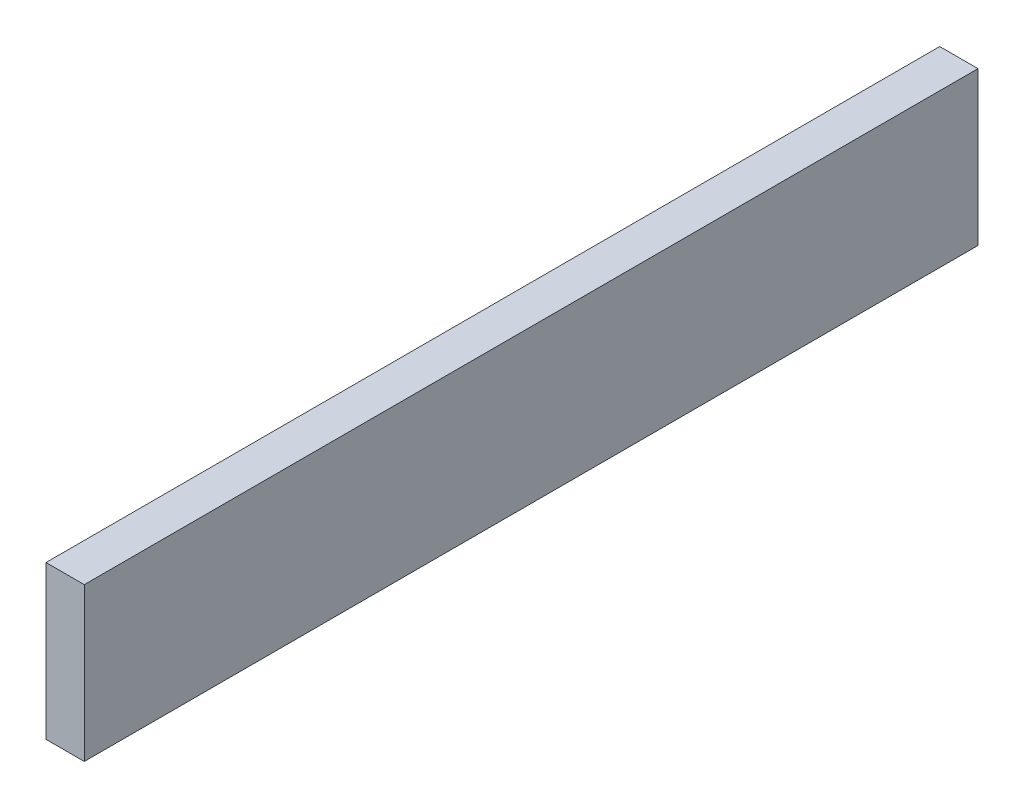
SolidWorks part; units mm, degrees
ref_plane "Front Plane" through (0, 0, 0) normal (0, 0, 1) x (1, 0, 0)
ref_plane "Top Plane" through (0, 0, 0) normal (0, 1, 0) x (1, 0, 0)
ref_plane "Right Plane" through (0, 0, 0) normal (1, 0, 0) x (0, 0, -1)
sketch "Sketch1" plane through (0, 0, 0) normal (0, 0, 1) x (1, 0, 0)
  line L1 (-12.7, -50.8) -> (12.7, -50.8)
  line L2 (-12.7, -50.8) -> (-12.7, 50.8)
  line L3 (-12.7, 50.8) -> (12.7, 50.8)
  line L4 (12.7, -50.8) -> (12.7, 50.8)
  line L5 (-12.7, -50.8) -> (12.7, 50.8) construction
  line L6 (-12.7, 50.8) -> (12.7, -50.8) construction
  point P0 (0, 0)
  dimension "D1" = 25.4
  dimension "D2" = 101.6
extrude "Boss-Extrude1" add sketch "Sketch1" along normal blind 592.836
